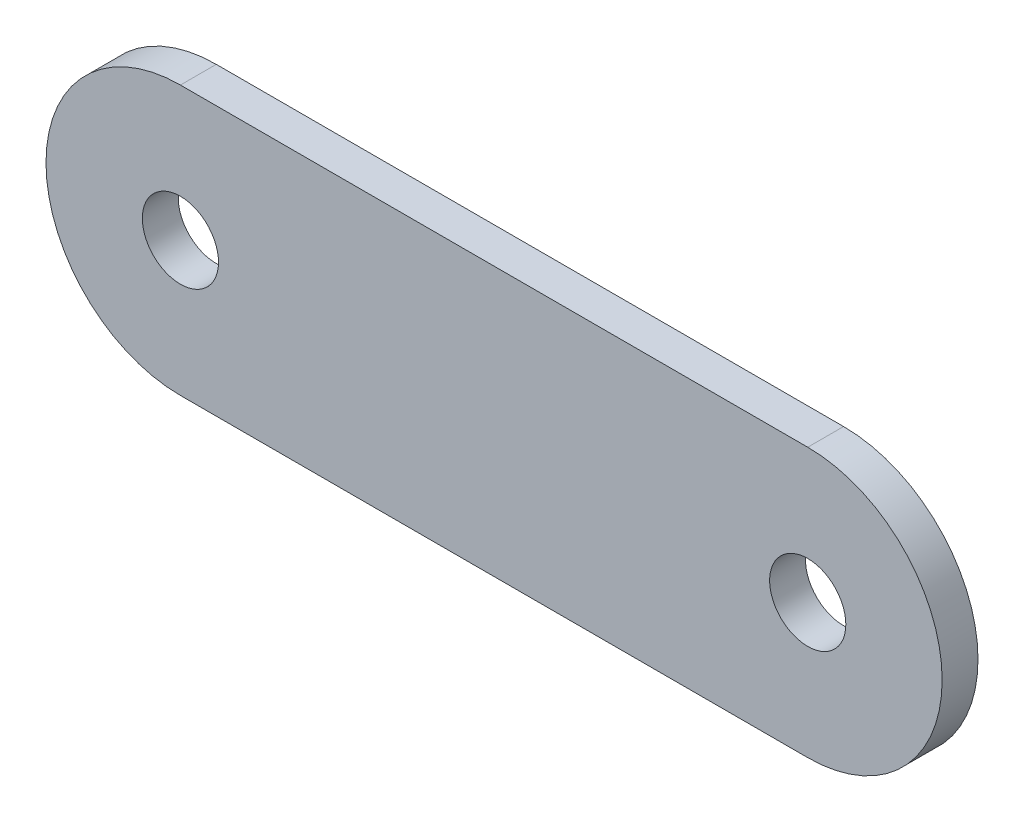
SolidWorks part; units mm, degrees
ref_plane "Plan de face" through (0, 0, 0) normal (0, 0, 1) x (1, 0, 0)
ref_plane "Plan de dessus" through (0, 0, 0) normal (0, 1, 0) x (1, 0, 0)
ref_plane "Plan de droite" through (0, 0, 0) normal (1, 0, 0) x (0, 0, -1)
sketch "Esquisse1" plane through (0, 0, 0) normal (0, 0, 1) x (1, 0, 0)
  line L0 (0, 0) -> (35, 0) construction
  line L1 (0, 7.5) -> (35, 7.5)
  line L2 (0, -7.5) -> (35, -7.5)
  arc A0 (0, 7.5) -> (0, -7.5) centre (0, 0) ccw
  arc A1 (35, -7.5) -> (35, 7.5) centre (35, 0) ccw
  circle A2 centre (0, 0) radius 2.125
  circle A3 centre (35, 0) radius 2.125
  point P3 (17.5, 0)
  dimension "D3" = 4.25
  dimension "D1" = 15
  dimension "D2" = 35
extrude "Boss.-Extru.1" add sketch "Esquisse1" along normal blind 2
